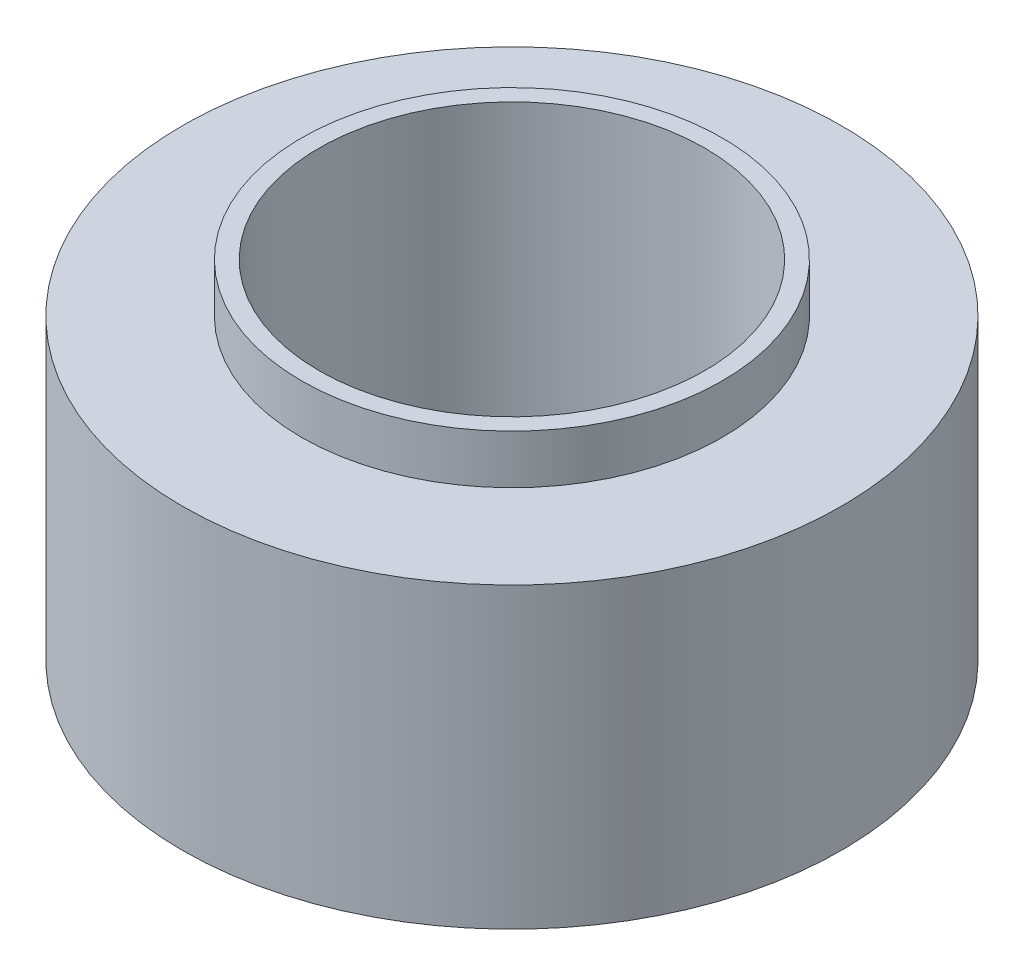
SolidWorks part; units mm, degrees
ref_plane "Front Plane" through (0, 0, 0) normal (0, 0, 1) x (1, 0, 0)
ref_plane "Top Plane" through (0, 0, 0) normal (0, 1, 0) x (1, 0, 0)
ref_plane "Right Plane" through (0, 0, 0) normal (1, 0, 0) x (0, 0, -1)
sketch "Sketch1" plane through (0, 0, 0) normal (0, 1, 0) x (1, 0, 0)
  circle A0 centre (0, 0) radius 9.398
  circle A1 centre (0, 0) radius 5.5
extrude "Boss-Extrude1" add sketch "Sketch1" along normal blind 8.5
sketch "Sketch2" plane through (0, 8.5, 0) normal (0, 1, 0) x (1, 0, 0)
  circle A0 centre (0, 0) radius 5.5
  circle A1 centre (0, 0) radius 6
extrude "Boss-Extrude2" add sketch "Sketch2" along normal blind 1.397
